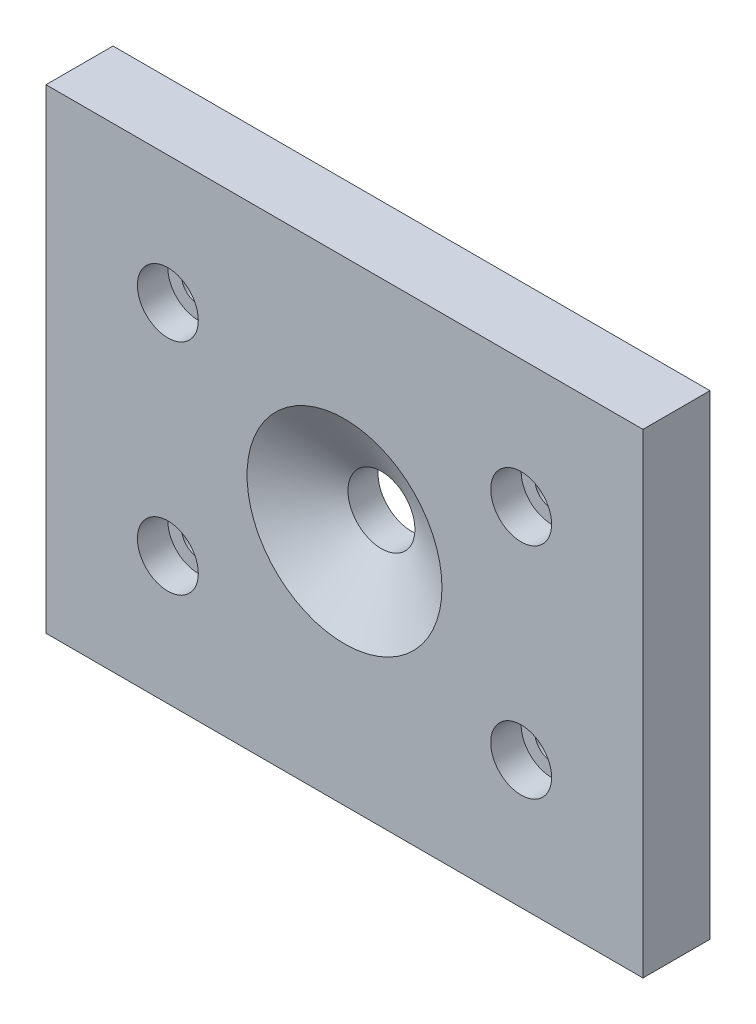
SolidWorks part; units mm, degrees
ref_plane "Face" through (0, 0, 0) normal (0, 0, 1) x (1, 0, 0)
ref_plane "Dessus" through (0, 0, 0) normal (0, 1, 0) x (1, 0, 0)
ref_plane "Droite" through (0, 0, 0) normal (1, 0, 0) x (0, 0, -1)
sketch "Esquisse1" plane through (0, 0, 0) normal (0, 0, 1) x (1, 0, 0)
  line L0 (0, 25.0296) -> (0, -52.1935) construction
  line L1 (-49, 39) -> (49, 39)
  line L2 (-49, 39) -> (-49, -39)
  line L3 (-49, -39) -> (49, -39)
  line L4 (49, 39) -> (49, -39)
  line L5 (-55.1039, 0) -> (76.835, 0) construction
  dimension "D1" = 98
  dimension "D2" = 78
extrude "Extrusion1" add sketch "Esquisse1" along normal blind 11
hole_wizard "Chambrage pour vis à tête cylindrique à 6 pans creux (vis CHC) M51" positions "Esquisse4" profile "Esquisse3" counterbore size "M5" standard "ISO"
sketch "Esquisse4" plane through (0, 0, 11) normal (0, 0, 1) x (1, 0, 0)
  line L0 (-26.4815, 0) -> (26.1699, 0) construction
  line L1 (0, 22.2756) -> (0, -15.4216) construction
  point P0 (-29, 18)
  point P1 (29, 18)
  point P2 (29, -18)
  point P3 (-29, -18)
  dimension "D1" = 58
  dimension "D2" = 36
sketch "Esquisse3" plane through (-29, 18, 11) normal (1, 0, 0) x (0, -1, 0)
  line L0 (0, 0) -> (0, 11)
  line L1 (0, 11) -> (2.75, 11)
  line L3 (2.75, 11) -> (2.75, 5)
  line L4 (2.75, 5) -> (5, 5)
  line L5 (5, 5) -> (5, 0)
  line L7 (5, 0) -> (0, 0)
  line L11 (0, -6.35) -> (0, 107.95) construction
  dimension "Diamètre du perçage jusqu'au prochain" = 5.5
  dimension "Profondeur du perçage jusqu'au prochain" = 11
  dimension "Diamètre du chambrage" = 10
  dimension "Profondeur du chambrage" = 5
sketch "Esquisse5" plane through (0, 0, 11) normal (0, 0, 1) x (1, 0, 0)
  circle A0 centre (0, 0) radius 5.5
  dimension "D1" = 11
extrude "Enlèv. mat.-Extru.1" cut sketch "Esquisse5" against normal through all
sketch "Esquisse6" plane through (0, 0, 11) normal (0, 0, 1) x (1, 0, 0)
  circle A0 centre (0, 0) radius 16
  dimension "D1" = 32
extrude "Enlèv. mat.-Extru.2" cut sketch "Esquisse6" against normal blind 10 draft 60
